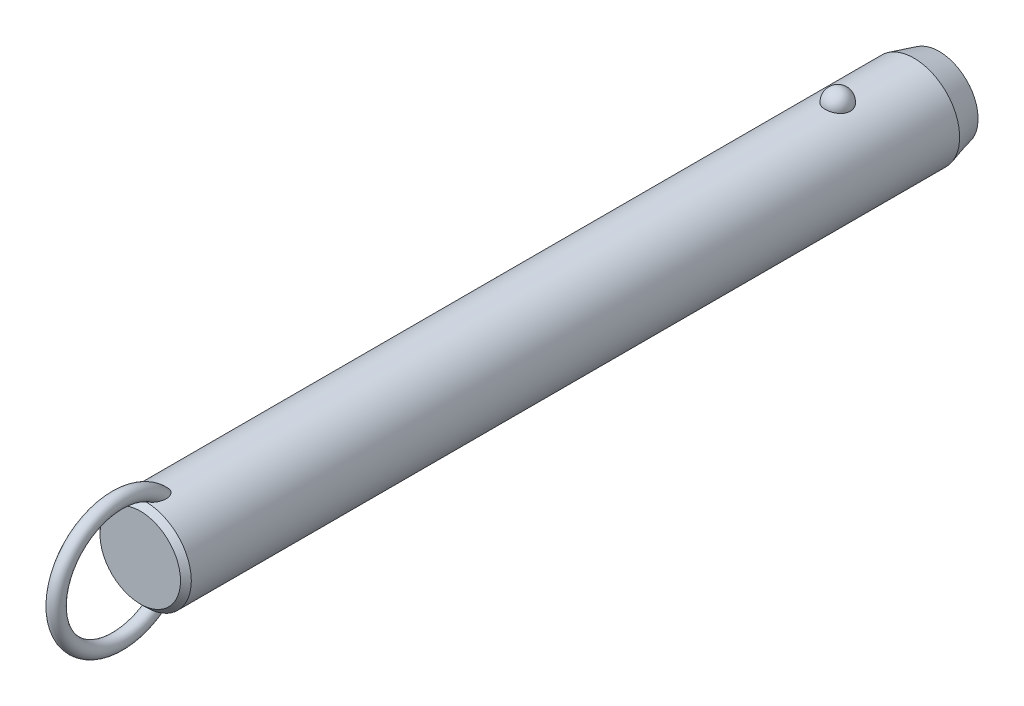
SolidWorks part; units mm, degrees
ref_plane "Front Plane" through (0, 0, 0) normal (0, 0, 1) x (1, 0, 0)
ref_plane "Top Plane" through (0, 0, 0) normal (0, 1, 0) x (1, 0, 0)
ref_plane "Right Plane" through (0, 0, 0) normal (1, 0, 0) x (0, 0, -1)
sketch "Sketch2" plane through (0, 0, 0) normal (0, 0, 1) x (1, 0, 0)
  circle A0 centre (0, 0) radius 12.7
  point P3 (0, 12.7)
  dimension "D1" = 25.4
extrude "Boss-Extrude1" add sketch "Sketch2" along normal blind 177.8
sketch "Sketch3" plane through (0, 0, 0) normal (0, 0, -1) x (-1, 0, 0)
  circle A0 centre (0, 0) radius 12.7
  dimension "D1" = 25.4
extrude "Boss-Extrude2" add sketch "Sketch3" along normal blind 31.7
chamfer "Chamfer1" distance 7 angle 15 1 edges at (-12.7, 0, -31.7)
sketch "Sketch12" plane through (0, 0, 0) normal (1, 0, 0) x (0, 0, -1)
  line L0 (-177.8, 12.7) -> (-177.8, -12.7) construction
  point P0 (-177.8, 0)
sketch "Sketch13" plane through (0, 0, 0) normal (1, 0, 0) x (0, 0, -1)
  circle A0 centre (-196.85, 0) radius 19.05
  point P2 (-177.8, 0)
  dimension "D1" = 38.1
sketch "Sketch14" plane through (0, 0, 0) normal (0, 1, 0) x (1, 0, 0)
  circle A0 centre (0, -179.8) radius 2
  point P2 (0, -177.8)
  dimension "D1" = 4
sweep "Sweep1" add profiles "Sketch14" path "Sketch13"
sketch "Sketch15" plane through (0, 0, 177.8) normal (0, 0, 1) x (1, 0, 0)
  circle A0 centre (0, 0) radius 12.7
  dimension "D1" = 25.4
extrude "Boss-Extrude3" add sketch "Sketch15" along normal blind 12.7
chamfer "Chamfer2" distance 1.5 angle 45 1 edges at (12.7, 0, 190.5)
sketch "Sketch18" plane through (0, 0, 0) normal (1, 0, 0) x (0, 0, -1)
  line L0 (24.7, 12.7) -> (-182.651, 12.7) construction
  line L1 (3.5, 16.2) -> (3.5, 9.2)
  line L2 (-182.651, -12.7) -> (24.7, -12.7) construction
  arc A0 (3.5, 16.2) -> (3.5, 9.2) centre (3.5, 12.7) ccw
  point P4 (0, 12.7)
  dimension "D1" = 28.9
revolve "Revolve1" add sketch "Sketch18" angle 360 about L1
